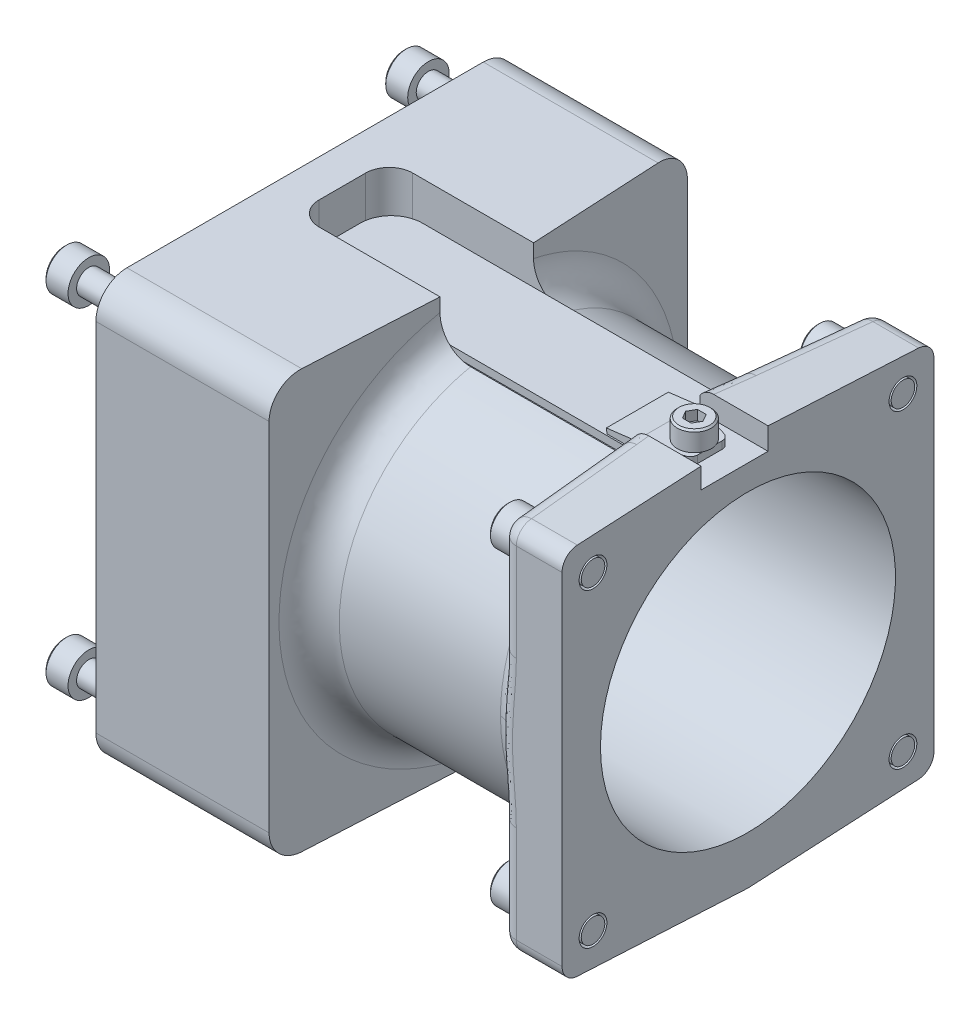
SolidWorks part; units mm, degrees
ref_plane "Front Plane" through (0, 0, 0) normal (0, 0, 1) x (1, 0, 0)
ref_plane "Top Plane" through (0, 0, 0) normal (0, 1, 0) x (1, 0, 0)
ref_plane "Right Plane" through (0, 0, 0) normal (1, 0, 0) x (0, 0, -1)
imported_body "Surface-Imported1"
imported_body "Imported1"
imported_body "Imported2"
imported_body "Imported3"
imported_body "Imported4"
imported_body "Imported5"
sketch "Sketch1" plane through (-42.2275, 0, 0) normal (-1, 0, 0) x (0, 0, 1)
  line L4 (44.323, -37.2364) -> (44.323, 51.4096)
  line L5 (37.973, 57.7596) -> (-37.973, 57.7596)
  line L6 (-44.323, 51.4096) -> (-44.323, -37.2364)
  line L7 (-37.973, -43.5864) -> (37.973, -43.5864)
  line L8 (44.323, -37.2364) -> (44.323, 51.4096)
  line L9 (37.973, 57.7596) -> (-37.973, 57.7596)
  line L10 (-44.323, 51.4096) -> (-44.323, -37.2364)
  line L11 (-37.973, -43.5864) -> (37.973, -43.5864)
  arc A4 (37.973, -43.5864) -> (44.323, -37.2364) centre (37.973, -37.2364) ccw
  arc A5 (44.323, 51.4096) -> (37.973, 57.7596) centre (37.973, 51.4096) ccw
  arc A6 (-37.973, 57.7596) -> (-44.323, 51.4096) centre (-37.973, 51.4096) ccw
  arc A7 (-44.323, -37.2364) -> (-37.973, -43.5864) centre (-37.973, -37.2364) ccw
  arc A8 (37.973, -43.5864) -> (44.323, -37.2364) centre (37.973, -37.2364) ccw
  arc A9 (44.323, 51.4096) -> (37.973, 57.7596) centre (37.973, 51.4096) ccw
  arc A10 (-37.973, 57.7596) -> (-44.323, 51.4096) centre (-37.973, 51.4096) ccw
  arc A11 (-44.323, -37.2364) -> (-37.973, -43.5864) centre (-37.973, -37.2364) ccw
  dimension "D1" = 0
extrude "Cut-Extrude1" cut sketch "Sketch1" along normal blind 0.0025
delete or keep bodies "Body-Delete/Keep 1" type keep bodies bodies 108 104 103 106 105
